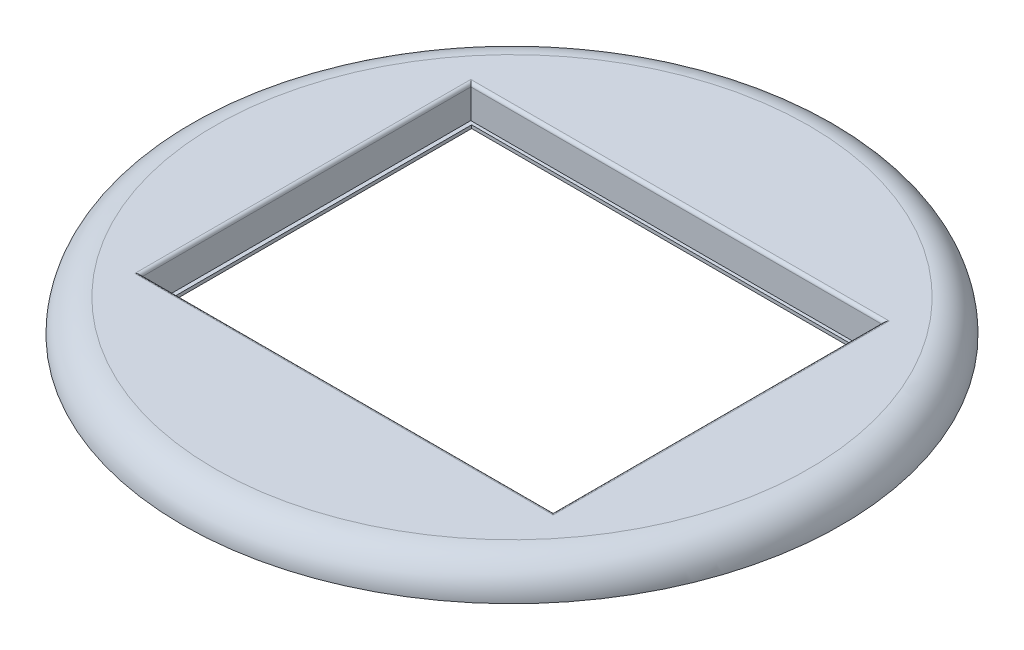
SolidWorks part; units mm, degrees
ref_plane "Front Plane" through (0, 0, 0) normal (0, 0, 1) x (1, 0, 0)
ref_plane "Top Plane" through (0, 0, 0) normal (0, 1, 0) x (1, 0, 0)
ref_plane "Right Plane" through (0, 0, 0) normal (1, 0, 0) x (0, 0, -1)
sketch "Sketch1" plane through (0, 0, 0) normal (0, 1, 0) x (1, 0, 0)
  line L1 (63.5, -50.8) -> (-63.5, -50.8)
  line L2 (63.5, -50.8) -> (63.5, 50.8)
  line L3 (63.5, 50.8) -> (-63.5, 50.8)
  line L4 (-63.5, -50.8) -> (-63.5, 50.8)
  line L5 (63.5, -50.8) -> (-63.5, 50.8) construction
  line L6 (63.5, 50.8) -> (-63.5, -50.8) construction
  circle A0 centre (0, 0) radius 101.6
  dimension "D1" = 203.2
  dimension "D2" = 101.6
  dimension "D3" = 127
extrude "Boss-Extrude1" add sketch "Sketch1" along normal blind 10
sketch "Sketch2" plane through (0, 0, 0) normal (0, -1, 0) x (1, 0, 0)
  line L1 (63.5, -50.8) -> (-63.5, -50.8)
  line L2 (63.5, -50.8) -> (63.5, 50.8)
  line L3 (63.5, 50.8) -> (-63.5, 50.8)
  line L4 (-63.5, -50.8) -> (-63.5, 50.8)
  line L5 (63.5, -50.8) -> (-63.5, 50.8) construction
  line L6 (63.5, 50.8) -> (-63.5, -50.8) construction
  line L7 (62.25, -49.8) -> (-62.25, -49.8)
  line L8 (62.25, -49.8) -> (62.25, 49.8)
  line L9 (62.25, 49.8) -> (-62.25, 49.8)
  line L10 (-62.25, -49.8) -> (-62.25, 49.8)
  line L11 (62.25, -49.8) -> (-62.25, 49.8) construction
  line L12 (62.25, 49.8) -> (-62.25, -49.8) construction
  point P0 (0, 0)
  point P7 (0, 0)
  dimension "D1" = 1
extrude "Boss-Extrude2" add sketch "Sketch2" along normal blind 1 separate body
fillet "Fillet1" radius 10 1 edges at (0, 10, 101.6)
fillet "Fillet2" radius 1 4 edges at (63.5, 10, 0) (0, 10, -50.8) (0, 10, 50.8) (-63.5, 10, 0)
